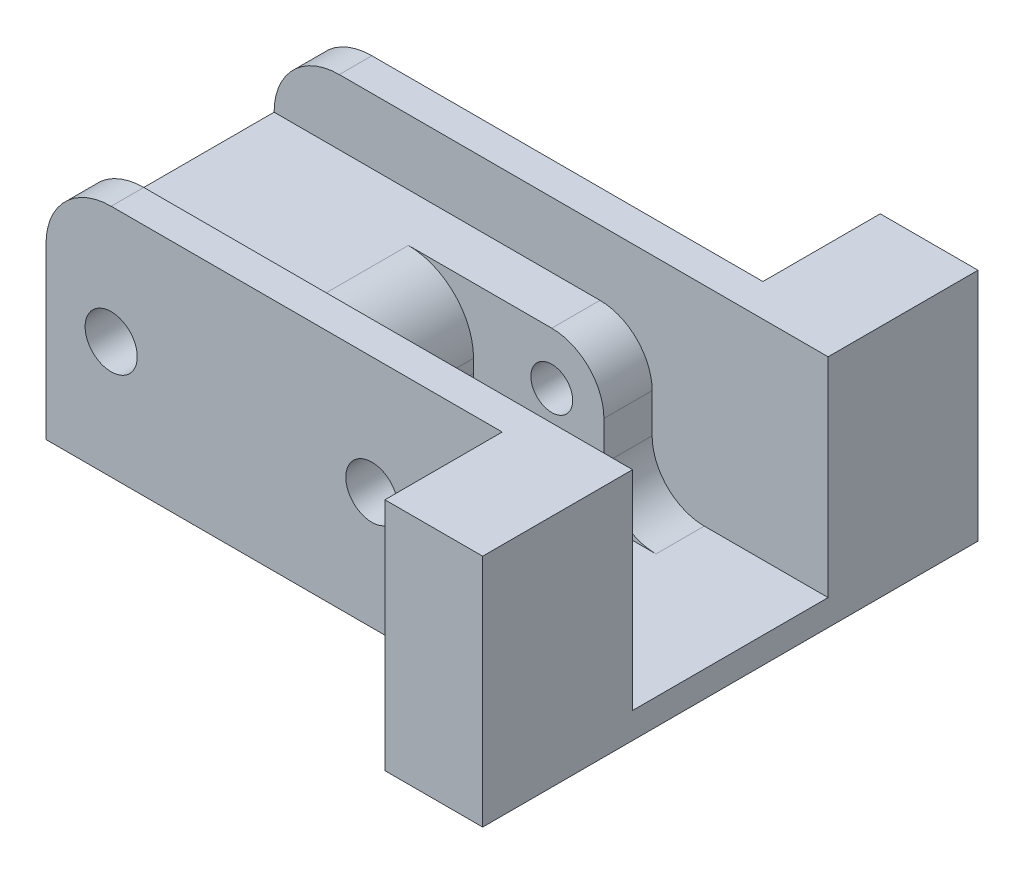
SolidWorks part; units mm, degrees
ref_plane "前视基准面" through (0, 0, 0) normal (0, 0, 1) x (1, 0, 0)
ref_plane "上视基准面" through (0, 0, 0) normal (0, 1, 0) x (1, 0, 0)
ref_plane "右视基准面" through (0, 0, 0) normal (1, 0, 0) x (0, 0, -1)
other "Configuration Table"
sketch "草图1" plane through (0, 0, 0) normal (0, 0, 1) x (1, 0, 0)
  line L0 (0, 0) -> (20, 0) construction
  line L5 (-5, 4) -> (24, 4)
  line L6 (24, 4) -> (24, -7)
  line L7 (24, -7) -> (37.5, -7)
  line L8 (37.5, -7) -> (37.5, -9)
  line L9 (37.5, -9) -> (-5, -9)
  line L10 (-5, -9) -> (-5, 4)
  circle A0 centre (0, 0) radius 1.605
  circle A1 centre (20, 0) radius 1.605
  dimension "D3" = 3.21
  dimension "D1" = 20
  dimension "D4" = 4
  dimension "D5" = 9
  dimension "D6" = 5
  dimension "D7" = 4
  dimension "D8" = 7
  dimension "D9" = 17.5
  dimension "D2" = 2
extrude "凸台-拉伸1" add sketch "草图1" along normal mid plane 20
sketch "草图2" plane through (0, 4, 0) normal (0, 1, 0) x (1, 0, 0)
  line L0 (24, -10) -> (24, 10) construction
  line L1 (14, -3.8) -> (24, -3.8)
  line L2 (14, -3.8) -> (14, 3.8)
  line L3 (14, 3.8) -> (24, 3.8)
  line L4 (24, -3.8) -> (24, 3.8)
  line L5 (14, -3.8) -> (24, 3.8) construction
  line L6 (14, 3.8) -> (24, -3.8) construction
  point P0 (19, 0)
  dimension "D1" = 7.6
  dimension "D2" = 10
extrude "切除-拉伸1" cut sketch "草图2" against normal blind 11
fillet "圆角1" radius 5 2 edges at (14, 4, 0) (14, -7, 0)
sketch "草图6" plane through (0, -7, 0) normal (0, 1, 0) x (1, 0, 0)
  line L0 (37.5, -10) -> (37.5, 10) construction
  line L1 (24, 10) -> (37.5, 10)
  line L2 (24, 10) -> (24, 7.5)
  line L3 (24, 7.5) -> (37.5, 7.5)
  line L4 (37.5, 10) -> (37.5, 7.5)
  line L6 (24, -10) -> (37.5, -10)
  line L7 (24, -10) -> (24, -7.5)
  line L8 (24, -7.5) -> (37.5, -7.5)
  line L9 (37.5, -10) -> (37.5, -7.5)
  dimension "D1" = 2.5
  dimension "D2" = 2.5
extrude "凸台-拉伸4" add sketch "草图6" along normal blind 11
sketch "草图7" plane through (0, 4, 0) normal (0, 1, 0) x (1, 0, 0)
  line L1 (37.5, 10) -> (30, 10)
  line L2 (37.5, 10) -> (37.5, 19)
  line L3 (37.5, 19) -> (30, 19)
  line L4 (30, 10) -> (30, 19)
  line L5 (37.5, -10) -> (30, -10)
  line L6 (37.5, -10) -> (37.5, -19)
  line L7 (37.5, -19) -> (30, -19)
  line L8 (30, -10) -> (30, -19)
  dimension "D1" = 7.5
  dimension "D2" = 9
extrude "凸台-拉伸5" add sketch "草图7" against normal blind 13
fillet "圆角3" radius 4 4 edges at (24, -7, 5.65) (24, -7, -5.65) (24, 4, -5.65) (24, 4, 5.65)
sketch "草图8" plane through (0, 4, 0) normal (0, 1, 0) x (1, 0, 0)
  line L0 (37.5, -7.5) -> (-5, -7.5)
  line L1 (-5, -10) -> (-5, 10) construction
  line L2 (-5, -7.5) -> (-5, -10)
  line L3 (-5, -10) -> (30, -10)
  line L4 (30, -10) -> (30, -19)
  line L5 (30, -19) -> (37.5, -19)
  line L6 (37.5, -19) -> (37.5, -7.5)
  line L7 (-5, 10) -> (30, 10)
  line L8 (30, 10) -> (30, 19)
  line L9 (30, 19) -> (37.5, 19)
  line L10 (37.5, 19) -> (37.5, 7.5)
  line L11 (37.5, 7.5) -> (-5, 7.5)
  line L12 (-5, 7.5) -> (-5, 10)
extrude "凸台-拉伸6" add sketch "草图8" along normal blind 5
sketch "草图9" plane through (-5, 0, 0) normal (-1, 0, 0) x (0, 0, 1)
  line L0 (-10, 9) -> (-10, -9)
  line L1 (-10, -9) -> (10, -9)
  line L2 (10, -9) -> (10, 9)
  line L3 (10, 9) -> (7.5, 9)
  line L4 (7.5, 9) -> (7.5, 4)
  line L5 (7.5, 4) -> (-7.5, 4)
  line L6 (-7.5, 4) -> (-7.5, 9)
  line L7 (-7.5, 9) -> (-10, 9)
extrude "凸台-拉伸7" [suppressed] add sketch "草图9" along normal blind 50
sketch "草图10" plane through (0, 0, 10) normal (0, 0, 1) x (1, 0, 0)
  circle A0 centre (-20, 0) radius 1.6
  circle A1 centre (-40, 0) radius 1.6
  dimension "D1" = 3.2
  dimension "D2" = 20
  dimension "D3" = 20
extrude "切除-拉伸2" [suppressed] cut sketch "草图10" against normal through all
fillet "圆角4" [suppressed] radius 5
fillet "圆角5" radius 5 2 edges at (-5, 9, 8.75) (-5, 9, -8.75)
sketch "草图11" plane through (0, 0, 10) normal (0, 0, 1) x (1, 0, 0)
  circle A0 centre (0, 0) radius 2
  circle A1 centre (20, 0) radius 2
  dimension "D1" = 4
extrude "切除-拉伸3" cut sketch "草图11" against normal blind 5
sketch "草图12" plane through (0, 0, -10) normal (0, 0, -1) x (-1, 0, 0)
  circle A0 centre (0, 0) radius 2
  dimension "D1" = 4
extrude "切除-拉伸4" cut sketch "草图12" against normal blind 5
